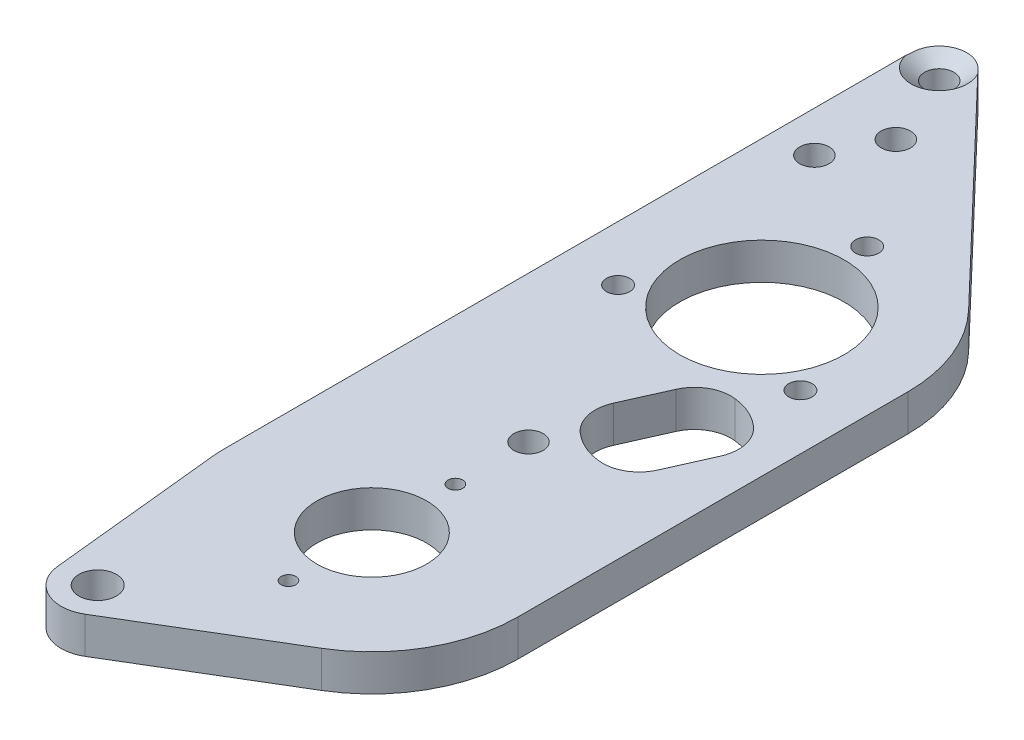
SolidWorks part; units mm, degrees
ref_plane "Front Plane" through (0, 0, 0) normal (0, 0, 1) x (1, 0, 0)
ref_plane "Top Plane" through (0, 0, 0) normal (0, 1, 0) x (1, 0, 0)
ref_plane "Right Plane" through (0, 0, 0) normal (1, 0, 0) x (0, 0, -1)
sketch "Sketch1" plane through (0, 0, 0) normal (0, 1, 0) x (1, 0, 0)
  line L0 (0, 0) -> (50.8, 0)
  line L1 (25.4, 0) -> (25.4, -152.4) construction
  line L2 (25.4, -152.4) -> (0, -152.4)
  line L3 (0, -152.4) -> (25.4, -152.4)
  line L4 (25.4, -152.4) -> (50.8, -152.4)
  line L5 (0, 0) -> (0, -152.4)
  line L6 (50.8, -152.4) -> (50.8, 0)
  line L9 (50.8, -152.4) -> (25.4, -152.4)
  circle A0 centre (25.4, -46.5328) radius 36.5125 construction
  circle A1 centre (25.4, -46.5328) radius 15.748 construction
  circle A2 centre (25.4, -114.3) radius 22.1488 construction
  circle A3 centre (25.4, -114.3) radius 9.906 construction
  circle A4 centre (25.4, -46.5328) radius 14.2875
  circle A5 centre (25.4, -114.3) radius 9.525
  circle A8 centre (9.525, -146.05) radius 3.2639
  dimension "D5" = 73.025
  dimension "D6" = 31.496
  dimension "D7" = 19.812
  dimension "D8" = 44.2976
  dimension "D9" = 28.575
  dimension "D10" = 19.05
  dimension "D11" = 6.5278
  dimension "D12" = 67.7672
  dimension "D13" = 6.35
  dimension "D15" = 9.525
  dimension "D1" = 50.8
  dimension "D2" = 152.4
  dimension "D3" = 50.8
  dimension "D14" = 38.1
extrude "Boss-Extrude1" add sketch "Sketch1" along normal blind 6.35 contours L0 L1 L4 L6 | L1 L0 L5 L2
hole_wizard "1/4-20 Tapped Hole1" positions "3DSketch1" profile "Sketch2" tap size "1/4-20" standard "ANSI Inch"
sketch3d "3DSketch1"
  line L0 (7.0995, 6.35, 0) -> (7.0995, 6.35, 19.1088) construction
  line L1 (0, 6.35, 0) -> (50.8, 6.35, 0) construction
  line L2 (0, 6.35, 0) -> (0, 6.35, 152.4) construction
  line L3 (0, 0, 0) -> (0, 0, 152.4) construction
  point P2 (7.0995, 6.35, 19.1088)
  point P16 (11.7863, 6.35, 9.652)
  point P18 (11.7863, 6.35, 9.652)
  dimension "D1" = 9.652
  dimension "D2" = 9.525
sketch "Sketch2" plane through (7.0995, 6.35, 19.1088) normal (1, 0, 0) x (0, 0, 1)
  line L0 (0, 0) -> (0, 6.35)
  line L1 (0, 6.35) -> (2.5527, 6.35)
  line L2 (2.5527, 6.35) -> (2.5527, 0)
  line L5 (2.5527, 0) -> (0, 0)
  line L11 (0, -6.35) -> (0, 107.95) construction
  dimension "Thru Tap Drill Dia." = 5.1054
  dimension "Thru Tap Drill Depth" = 6.35
fillet "Fillet1" radius 19.05 1 edges at (50.8, 3.175, 152.4)
sketch "Sketch3" plane through (0, 0, 0) normal (0, -1, 0) x (1, 0, 0)
  line L0 (50.8, 0) -> (31.75, 0)
  line L1 (0, 0) -> (50.8, 0) construction
  line L2 (31.75, 0) -> (50.8, 31.75)
  line L3 (50.8, 133.35) -> (50.8, 0) construction
  line L4 (50.8, 31.75) -> (50.8, 0)
  dimension "D1" = 31.75
  dimension "D2" = 19.05
extrude "Cut-Extrude1" cut sketch "Sketch3" against normal through all
sketch "Sketch4" plane through (0, 0, 0) normal (0, -1, 0) x (1, 0, 0)
  line L0 (0, 0) -> (0, -4.9137)
  line L1 (31.75, 0) -> (6.4161, -9.3799)
  line L4 (0, 0) -> (0, 152.4) construction
  circle A1 centre (4.7625, -4.9137) radius 2.5527
  arc A3 (0, -4.9137) -> (6.4161, -9.3799) centre (4.7625, -4.9137) ccw
  dimension "D1" = 5.1054
  dimension "D4" = 9.525
extrude "Boss-Extrude2" add sketch "Sketch4" against normal blind 6.35
sketch "Sketch5" plane through (0, 0, 0) normal (0, -1, 0) x (1, 0, 0)
  circle A0 centre (25.4, 128.778) radius 1.27
  circle A1 centre (25.4, 99.7788) radius 1.27
  circle A2 centre (25.4, 114.3) radius 9.525 construction
  circle A3 centre (25.4, 114.3) radius 9.525 construction
  circle A4 centre (25.4, 87.0788) radius 4.7625 construction
  circle A5 centre (25.4, 46.5328) radius 36.576 construction
  circle A6 centre (25.4, 87.0788) radius 2.5527
  dimension "D3" = 2.54
  dimension "D4" = 73.152
  dimension "D5" = 9.525
  dimension "D6" = 5.1054
  dimension "D1" = 28.9992
  dimension "D2" = 14.478
  dimension "D7" = 12.7
extrude "Cut-Extrude2" cut sketch "Sketch5" against normal through all
sketch "Sketch6" plane through (0, 0, 0) normal (0, -1, 0) x (1, 0, 0)
  line L0 (12.7935, 151.4942) -> (38.4738, 136.0769)
  line L1 (3.2085, 146.7018) -> (0.1342, 116.9071)
  line L2 (43.7585, 28.9793) -> (8.2047, -8.2049)
  line L3 (0, -4.9137) -> (0, 152.4) construction
  line L4 (0, -4.9137) -> (0, 152.4)
  line L5 (50.8, 133.35) -> (50.8, 31.75) construction
  line L6 (50.8, 133.35) -> (50.8, 31.75)
  line L12 (0, 152.4) -> (0, -4.9137)
  line L13 (6.4161, -9.3799) -> (31.75, 0)
  line L14 (31.75, 0) -> (50.8, 31.75)
  line L15 (50.8, 31.75) -> (50.8, 133.35)
  line L16 (31.75, 152.4) -> (0, 152.4)
  line L17 (0, 152.4) -> (0, -4.9137)
  line L18 (6.4161, -9.3799) -> (31.75, 0)
  line L19 (31.75, 0) -> (50.8, 31.75)
  line L20 (50.8, 31.75) -> (50.8, 133.35)
  line L21 (31.75, 152.4) -> (0, 152.4)
  arc A0 (12.7935, 151.4942) -> (3.2085, 146.7018) centre (9.525, 146.05) ccw
  arc A1 (0.1342, 116.9071) -> (38.4738, 136.0769) centre (25.4, 114.3) ccw
  circle A2 centre (25.4, 46.5328) radius 25.4
  circle A3 centre (4.7625, -4.9137) radius 4.7625
  arc A4 (0, -4.9137) -> (6.4161, -9.3799) centre (4.7625, -4.9137) ccw construction
  arc A7 (0, -4.9137) -> (6.4161, -9.3799) centre (4.7625, -4.9137) ccw
  arc A8 (50.8, 133.35) -> (31.75, 152.4) centre (31.75, 133.35) ccw
  arc A9 (0, -4.9137) -> (6.4161, -9.3799) centre (4.7625, -4.9137) ccw
  arc A10 (50.8, 133.35) -> (31.75, 152.4) centre (31.75, 133.35) ccw
  dimension "D1" = 12.7
  dimension "D4" = 0
extrude "Cut-Extrude3" cut sketch "Sketch6" against normal through all contours A1 L20 A0 L0 M24 M25 | A1 L1 A0 L21 M19 | A3 A2 L2 M21 M22 M23
hole_wizard "CSK for #10 Flat Head Machine Screw (100)1" positions "Sketch8" profile "Sketch7" countersink size "#10" standard "ANSI Inch"
sketch "Sketch8" plane through (0, 6.35, 0) normal (0, 1, 0) x (1, 0, 0)
  point P0 (4.7625, 4.9137)
sketch "Sketch7" plane through (4.7625, 6.35, -4.9137) normal (1, 0, 0) x (0, 0, 1)
  line L0 (0, 0) -> (0, 6.3217)
  line L1 (0, 6.3217) -> (2.4892, 4.826)
  line L2 (2.4892, 4.826) -> (2.4892, 2.0141)
  line L3 (2.4892, 2.0141) -> (4.8895, 0)
  line L5 (4.8895, 0) -> (0, 0)
  line L6 (-2.4892, 2.0141) -> (-4.8895, 0) construction
  line L10 (0, 6.3217) -> (-2.4892, 4.826) construction
  line L11 (0, -6.35) -> (0, 107.95) construction
  dimension "Hole Dia." = 4.9784
  dimension "Hole Depth" = 4.826
  dimension "Near C'Sink Dia." = 9.779
  dimension "Near C'Sink Angle" = 100
  dimension "Drill Angle" = 118
sketch "Sketch11" plane through (0, 0, 0) normal (0, -1, 0) x (1, 0, 0)
  line L2 (31.6355, 63.2829) -> (25.5621, 76.924)
  line L3 (39.4845, 83.1227) -> (45.5579, 69.4816)
  line L4 (50.8, 114.3) -> (50.8, 46.5328) construction
  line L6 (28.5988, 70.1035) -> (42.5212, 76.3021) construction
  arc A2 (31.6355, 63.2829) -> (45.5579, 69.4816) centre (35.56, 73.2028) ccw
  arc A3 (39.4845, 83.1227) -> (25.5621, 76.924) centre (35.56, 73.2028) ccw
  point P2 (42.5212, 76.3021)
  dimension "D1" = 10.668
  dimension "D2" = 15.24
  dimension "D3" = 15.24
  dimension "D4" = 26.67
  dimension "D5" = 24
extrude "Cut-Extrude4" cut sketch "Sketch11" against normal through all
fillet "Fillet2" radius 6.35 4 edges at (25.5621, 3.175, 76.924) (39.4845, 3.175, 83.1227) (45.5579, 3.175, 69.4816) (31.6355, 3.175, 63.2829)
sketch "Sketch13" plane through (0, 6.35, 0) normal (0, 1, 0) x (1, 0, 0)
  line L0 (25.4, -46.5328) -> (9.5621, -55.6768) construction
  line L1 (25.4, -46.5328) -> (41.2379, -55.6768) construction
  line L2 (25.4, -46.5328) -> (25.4, -28.2448) construction
  circle A0 centre (25.4, -46.5328) radius 15.5575 construction
  circle A1 centre (25.4, -46.5328) radius 14.2875 construction
  point P4 (25.4, -28.2448)
  point P5 (9.5621, -55.6768)
  point P6 (41.2379, -55.6768)
  dimension "D1" = 31.115
  dimension "D2" = 120
  dimension "D3" = 120
  dimension "D4" = 18.288
hole_wizard "#10-32 Tapped Hole1" positions "3DSketch2" profile "Sketch14" tap size "#10-32" standard "ANSI Inch"
sketch3d "3DSketch2"
  point P0 (9.5621, 6.35, 55.6768)
  point P3 (25.4, 6.35, 28.2448)
  point P6 (41.2379, 6.35, 55.6768)
sketch "Sketch14" plane through (9.5621, 6.35, 55.6768) normal (1, 0, 0) x (0, 0, 1)
  line L0 (0, 0) -> (0, 6.35)
  line L1 (0, 6.35) -> (2.0193, 6.35)
  line L2 (2.0193, 6.35) -> (2.0193, 0)
  line L5 (2.0193, 0) -> (0, 0)
  line L11 (0, -6.35) -> (0, 107.95) construction
  dimension "Thru Tap Drill Dia." = 4.0386
  dimension "Thru Tap Drill Depth" = 6.35
